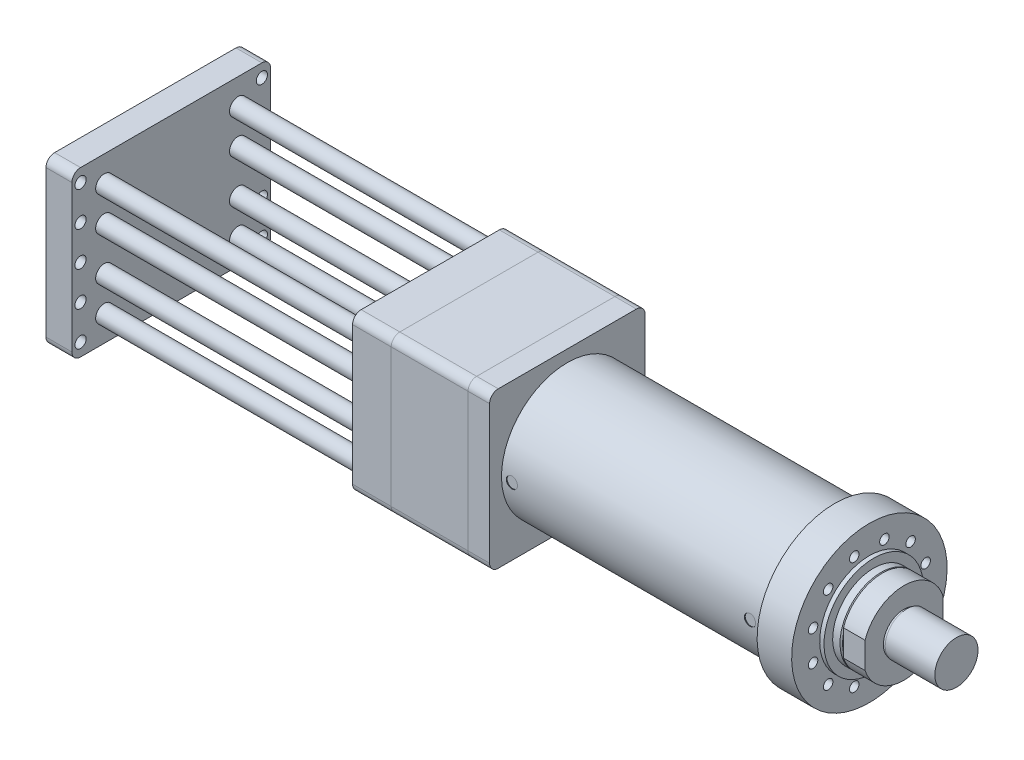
SolidWorks part; units mm, degrees
ref_plane "前视基准面" through (0, 0, 0) normal (0, 0, 1) x (1, 0, 0)
ref_plane "上视基准面" through (0, 0, 0) normal (0, 1, 0) x (1, 0, 0)
ref_plane "右视基准面" through (0, 0, 0) normal (1, 0, 0) x (0, 0, -1)
sketch "草图2" plane through (0, 0, 0) normal (0, 0, 1) x (1, 0, 0)
  line L0 (0, 0) -> (0, 152.5)
  line L1 (0, 152.5) -> (619.5, 152.5)
  line L6 (619.5, 152.5) -> (619.5, 0)
  line L7 (619.5, 0) -> (0, 0)
  dimension "D1" = 152.5
  dimension "D4" = 619.5
revolve "旋转1" add sketch "草图2" angle 360 about L7
sketch "草图3" plane through (619.5, 0, 0) normal (1, 0, 0) x (0, 0, -1)
  line L0 (0, 0) -> (232.7364, 0) construction
  line L1 (0, 0) -> (226.3775, 60.6577) construction
  circle A0 centre (0, 0) radius 180
  circle A1 centre (0, 0) radius 135 construction
  circle A2 centre (130.4, 34.9406) radius 11
  circle A3 centre (130.4, -34.9406) radius 11
  circle A4 centre (95.4594, -95.4594) radius 11
  circle A5 centre (34.9406, -130.4) radius 11
  circle A6 centre (-34.9406, -130.4) radius 11
  circle A7 centre (-95.4594, -95.4594) radius 11
  circle A8 centre (-130.4, -34.9406) radius 11
  circle A9 centre (-130.4, 34.9406) radius 11
  circle A10 centre (-95.4594, 95.4594) radius 11
  circle A11 centre (-34.9406, 130.4) radius 11
  circle A12 centre (34.9406, 130.4) radius 11
  circle A13 centre (95.4594, 95.4594) radius 11
  point P32 (0, 0)
  dimension "D1" = 360
  dimension "D2" = 270
  dimension "D4" = 22
  dimension "D3" = 15
  dimension "D5" = 12
extrude "凸台-拉伸1" add sketch "草图3" along normal blind 80
sketch "草图4" plane through (699.5, 0, 0) normal (1, 0, 0) x (0, 0, -1)
  circle A0 centre (0, 0) radius 115
  dimension "D1" = 230
extrude "凸台-拉伸2" add sketch "草图4" along normal blind 10
sketch "草图5" plane through (709.5, 0, 0) normal (1, 0, 0) x (0, 0, -1)
  circle A0 centre (0, 0) radius 95
  dimension "D1" = 190
extrude "凸台-拉伸3" add sketch "草图5" along normal blind 20
chamfer "倒角1" distance 3 angle 45 1 edges at (729.5, 95, 0)
ref_plane "基准面1" through (0, 0, 152.5) normal (0, 0, 1) x (1, 0, 0)
ref_plane "基准面2" through (0, 0, -152.5) normal (0, 0, 1) x (1, 0, 0)
sketch "草图17" plane through (0, 0, -152.5) normal (0, 0, 1) x (1, 0, 0)
  circle A0 centre (44, 0) radius 13
  dimension "D1" = 26
  dimension "D2" = 44
extrude "切除-拉伸6" cut sketch "草图17" along normal blind 2
sketch "草图19" plane through (0, 0, 152.5) normal (0, 0, 1) x (1, 0, 0)
  line L0 (619.5, 180) -> (619.5, -180) construction
  circle A0 centre (24, 0) radius 13
  circle A1 centre (575.5, 0) radius 13
  dimension "D1" = 24
  dimension "D2" = 26
  dimension "D3" = 26
  dimension "D4" = 44
extrude "切除-拉伸7" cut sketch "草图19" against normal blind 2
sketch "草图23" plane through (0, 0, 0) normal (-1, 0, 0) x (0, 0, 1)
  line L1 (-180, 180) -> (180, 180)
  line L2 (-180, 180) -> (-180, -180)
  line L3 (-180, -180) -> (180, -180)
  line L4 (180, 180) -> (180, -180)
  line L5 (-180, 180) -> (180, -180) construction
  line L6 (-180, -180) -> (180, 180) construction
  circle A0 centre (0, 0) radius 180 construction
  dimension "D1" = 360
  dimension "D2" = 360
  dimension "D3" = 360
extrude "凸台-拉伸8" add sketch "草图23" along normal blind 50
sketch "草图24" plane through (729.5, 0, 0) normal (1, 0, 0) x (0, 0, -1)
  line L2 (-90, 30.4138) -> (-90, -30.4138)
  line L4 (90, 30.4138) -> (90, -30.4138)
  line L5 (-58.2393, 75.0546) -> (58.2393, -75.0546) construction
  line L6 (-58.2393, -75.0546) -> (58.2393, 75.0546) construction
  arc A0 (-90, -30.4138) -> (90, -30.4138) centre (0, 0) ccw
  arc A1 (90, 30.4138) -> (-90, 30.4138) centre (0, 0) ccw
  dimension "D1" = 190
extrude "凸台-拉伸9" add sketch "草图24" along normal blind 50
sketch "草图25" plane through (779.5, 0, 0) normal (1, 0, 0) x (0, 0, -1)
  circle A0 centre (0, 0) radius 47.5
  dimension "D1" = 95
extrude "凸台-拉伸10" add sketch "草图25" along normal blind 5
sketch "草图26" plane through (784.5, 0, 0) normal (1, 0, 0) x (0, 0, -1)
  circle A0 centre (1.644, 0) radius 50
  dimension "D1" = 100
extrude "凸台-拉伸11" add sketch "草图26" along normal blind 115
sketch "草图28" plane through (-50, 0, 0) normal (-1, 0, 0) x (0, 0, 1)
  line L1 (-180, 180) -> (180, 180)
  line L2 (-180, 180) -> (-180, -180)
  line L3 (-180, -180) -> (180, -180)
  line L4 (180, 180) -> (180, -180)
  line L5 (-180, 180) -> (180, -180) construction
  line L6 (-180, -180) -> (180, 180) construction
  point P0 (0, 0)
extrude "凸台-拉伸12" add sketch "草图28" along normal blind 178 separate body
sketch "草图29" plane through (-228, 0, 0) normal (-1, 0, 0) x (0, 0, 1)
  line L1 (-180, 180) -> (180, 180)
  line L2 (-180, 180) -> (-180, -180)
  line L3 (-180, -180) -> (180, -180)
  line L4 (180, 180) -> (180, -180)
  line L5 (-180, 180) -> (180, -180) construction
  line L6 (-180, -180) -> (180, 180) construction
  point P0 (0, 0)
extrude "凸台-拉伸13" add sketch "草图29" along normal blind 89.5 separate body
fillet "圆角1" radius 20 4 edges at (-25, -180, -180) (-25, 180, -180) (-25, -180, 180) (-25, 180, 180)
fillet "圆角2" radius 20 4 edges at (-139, -180, 180) (-139, 180, 180) (-139, -180, -180) (-139, 180, -180)
fillet "圆角3" radius 20 4 edges at (-272.75, -180, 180) (-272.75, 180, 180) (-272.75, -180, -180) (-272.75, 180, -180)
sketch "草图30" plane through (-317.5, 0, 0) normal (-1, 0, 0) x (0, 0, 1)
  line L0 (-180, 160) -> (-180, -160) construction
  line L1 (-160, -180) -> (160, -180) construction
  line L2 (160, 180) -> (-160, 180) construction
  line L3 (0, 180) -> (0, 0) construction
  circle A0 centre (-155, 130) radius 20
  circle A1 centre (-155, 50) radius 20
  circle A2 centre (-155, -50) radius 20
  circle A3 centre (-155, -130) radius 20
  circle A4 centre (155, -130) radius 20
  circle A5 centre (155, -50) radius 20
  circle A6 centre (155, 50) radius 20
  circle A7 centre (155, 130) radius 20
  dimension "D1" = 40
  dimension "D2" = 40
  dimension "D3" = 40
  dimension "D4" = 40
  dimension "D5" = 25
  dimension "D6" = 50
  dimension "D7" = 50
  dimension "D8" = 80
  dimension "D9" = 80
extrude "凸台-拉伸14" add sketch "草图30" along normal blind 600
sketch "草图31" plane through (-917.5, 0, 0) normal (-1, 0, 0) x (0, 0, 1)
  line L0 (0, 190) -> (0, 0) construction
  line L1 (-230, 190) -> (230, 190)
  line L2 (-230, 190) -> (-230, -190)
  line L3 (-230, -190) -> (230, -190)
  line L4 (230, 190) -> (230, -190)
  line L5 (-230, 190) -> (230, -190) construction
  line L6 (-230, -190) -> (230, 190) construction
  circle A0 centre (-210, 160) radius 13
  circle A1 centre (-210, 0) radius 13
  circle A2 centre (-210, -80) radius 13
  circle A3 centre (-210, -160) radius 13
  circle A4 centre (-210, 80) radius 13
  circle A5 centre (210, -160) radius 13
  circle A6 centre (210, -80) radius 13
  circle A7 centre (210, 0) radius 13
  circle A8 centre (210, 80) radius 13
  circle A9 centre (210, 160) radius 13
  point P0 (0, 0)
  dimension "D3" = 26
  dimension "D4" = 26
  dimension "D5" = 26
  dimension "D6" = 26
  dimension "D7" = 26
  dimension "D1" = 460
  dimension "D2" = 380
  dimension "D8" = 210
  dimension "D9" = 80
  dimension "D10" = 80
  dimension "D11" = 80
  dimension "D12" = 80
  dimension "D13" = 30
extrude "凸台-拉伸15" add sketch "草图31" along normal blind 60
fillet "圆角4" radius 20 4 edges at (-947.5, -190, -230) (-947.5, -190, 230) (-947.5, 190, -230) (-947.5, 190, 230)
